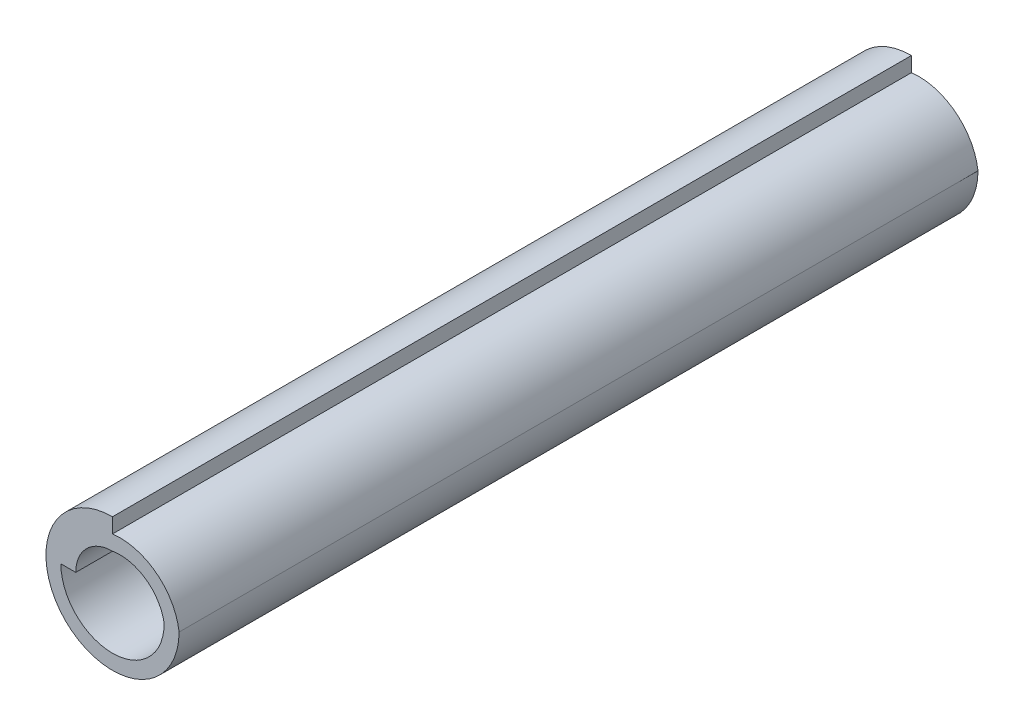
SolidWorks part; units mm, degrees
ref_plane "Plane1" through (0, 0, 0) normal (0, 0, 1) x (1, 0, 0)
ref_plane "Plane2" through (0, 0, 0) normal (0, 1, 0) x (1, 0, 0)
ref_plane "Plane3" through (0, 0, 0) normal (1, 0, 0) x (0, 0, -1)
sketch "Sketch1" plane through (0, 0, 0) normal (0, 0, 1) x (1, 0, 0)
  line L0 (0, 1.94) -> (0, 2.5)
  line L1 (-1.94, 0) -> (-1.38, 0)
  line L2 (0, 1.38) -> (1.94, 0) construction
  line L3 (0.28, -0.28) -> (0.97, 0.69) construction
  line L4 (0, 1.94) -> (2.5, 0) construction
  line L5 (0.28, -0.28) -> (1.25, 0.97) construction
  arc A0 (0, 2.5) -> (2.5, 0) centre (0, 0) ccw
  arc A1 (-1.94, 0) -> (1.94, 0) centre (0, 0) ccw
  arc A2 (0, 1.38) -> (-1.38, 0) centre (0, 0) ccw
  arc A3 (1.94, 0) -> (0, 1.38) centre (0.28, -0.28) ccw
  arc A4 (2.5, 0) -> (0, 1.94) centre (0.28, -0.28) ccw
  dimension "D1" = 0.56
  dimension "Diameter" = 5
  dimension "D2" = 3.88
  dimension "Thickness" = 0.56
extrude "Base-Extrude" add sketch "Sketch1" along normal mid plane 30
equation "\"D1@Sketch1\" = \"Thickness@Sketch1\""
equation "\"D2@Sketch1\" = \"Diameter@Sketch1\" - \"Thickness@Sketch1\" * 2"
